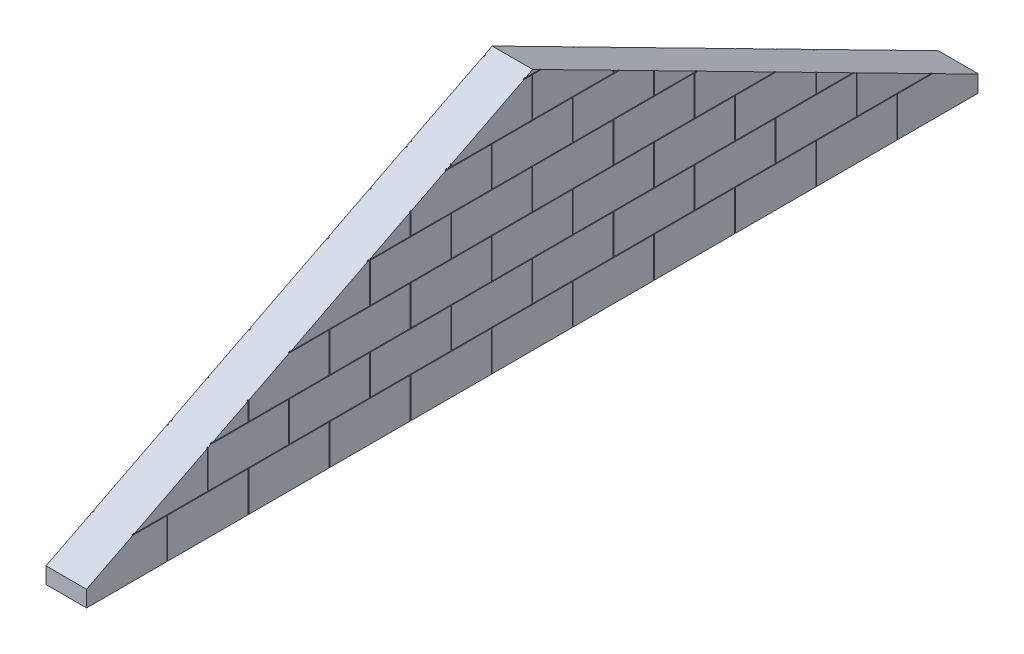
SolidWorks part; units mm, degrees
ref_plane "Face" through (0, 0, 0) normal (0, 0, 1) x (1, 0, 0)
ref_plane "Dessus" through (0, 0, 0) normal (0, 1, 0) x (1, 0, 0)
ref_plane "Droite" through (0, 0, 0) normal (1, 0, 0) x (0, 0, -1)
sketch "Esquisse1" plane through (0, 0, 0) normal (1, 0, 0) x (0, 0, -1)
  line L0 (0, 0) -> (550, 0)
  line L1 (550, 0) -> (550, 10.0035)
  line L2 (0, 0) -> (0, 10)
  line L3 (0, 10) -> (275, 150)
  line L4 (550, 10.0035) -> (275, 150)
  dimension "D1" = 550
  dimension "D2" = 275
  dimension "D3" = 150
  dimension "D4" = 10
  dimension "D5" = 10
extrude "Extrusion1" add sketch "Esquisse1" along normal blind 25
sketch "Esquisse4" plane through (25, 0, 0) normal (1, 0, 0) x (0, 0, -1)
  line L0 (0, 0) -> (550, 0) construction
  line L1 (0, 24.5) -> (650, 24.5)
  line L2 (0, 24.5) -> (0, 25)
  line L3 (0, 25) -> (650, 25)
  line L4 (650, 24.5) -> (650, 25)
  dimension "D1" = 650
  dimension "D2" = 0.5
  dimension "D3" = 24.5
extrude "Enlèv. mat.-Extru.2" cut sketch "Esquisse4" against normal blind 0.5
ref_plane "Plan1" through (12.5, 0, 0) normal (1, 0, 0) x (0, 0, -1)
mirror "Symétrie1" about plane through (12.5, 0, 0) normal (1, 0, 0) of "Enlèv. mat.-Extru.2"
sketch "Esquisse5" plane through (25, 0, 0) normal (1, 0, 0) x (0, 0, -1)
  line L1 (50, 0) -> (49.5, 0)
  line L2 (50, 0) -> (50, 24.5)
  line L3 (50, 24.5) -> (49.5, 24.5)
  line L4 (49.5, 0) -> (49.5, 24.5)
  dimension "D1" = 24.5
  dimension "D2" = 0.5
  dimension "D3" = 49.5
extrude "Enlèv. mat.-Extru.3" cut sketch "Esquisse5" against normal blind 0.5
pattern_linear "Répétition linéaire3" count 12 spacing 50 along (0, 0, -1) of "Enlèv. mat.-Extru.3"
mirror "Symétrie3" about plane through (12.5, 0, 0) normal (1, 0, 0) of "Enlèv. mat.-Extru.3"
pattern_linear "Répétition linéaire4" count 5 spacing 49 along (0, 1, 0) of "Répétition linéaire3"
mirror "Symétrie4" about plane through (12.5, 0, 0) normal (1, 0, 0) of "Répétition linéaire4", "Répétition linéaire3"
sketch "Esquisse7" plane through (25, 0, 0) normal (1, 0, 0) x (0, 0, -1)
  line L0 (520.5419, 25) -> (29.4643, 25) construction
  line L1 (74.5, 25) -> (75, 25)
  line L2 (74.5, 25) -> (74.5, 49)
  line L3 (74.5, 49) -> (75, 49)
  line L4 (75, 25) -> (75, 49)
  dimension "D1" = 24
  dimension "D2" = 0.5
  dimension "D3" = 74.5
extrude "Enlèv. mat.-Extru.4" cut sketch "Esquisse7" against normal blind 0.5
pattern_linear "Répétition linéaire5" count 11 spacing 50 along (0, 0, -1) of "Enlèv. mat.-Extru.4"
mirror "Symétrie8" about plane through (12.5, 0, 0) normal (1, 0, 0) of "Enlèv. mat.-Extru.4"
pattern_linear "Répétition linéaire8" count 10 spacing 50 along (0, 0, -1) of "Symétrie8"
pattern_linear "Répétition linéaire9" count 6 spacing 24.55 along (0, 1, 0) of "Enlèv. mat.-Extru.2"
pattern_linear "Répétition linéaire10" count 3 spacing 49.1 along (0, 1, 0) of "Répétition linéaire8"
mirror "Symétrie9" about plane through (12.5, 0, 0) normal (1, 0, 0) of "Répétition linéaire9"
